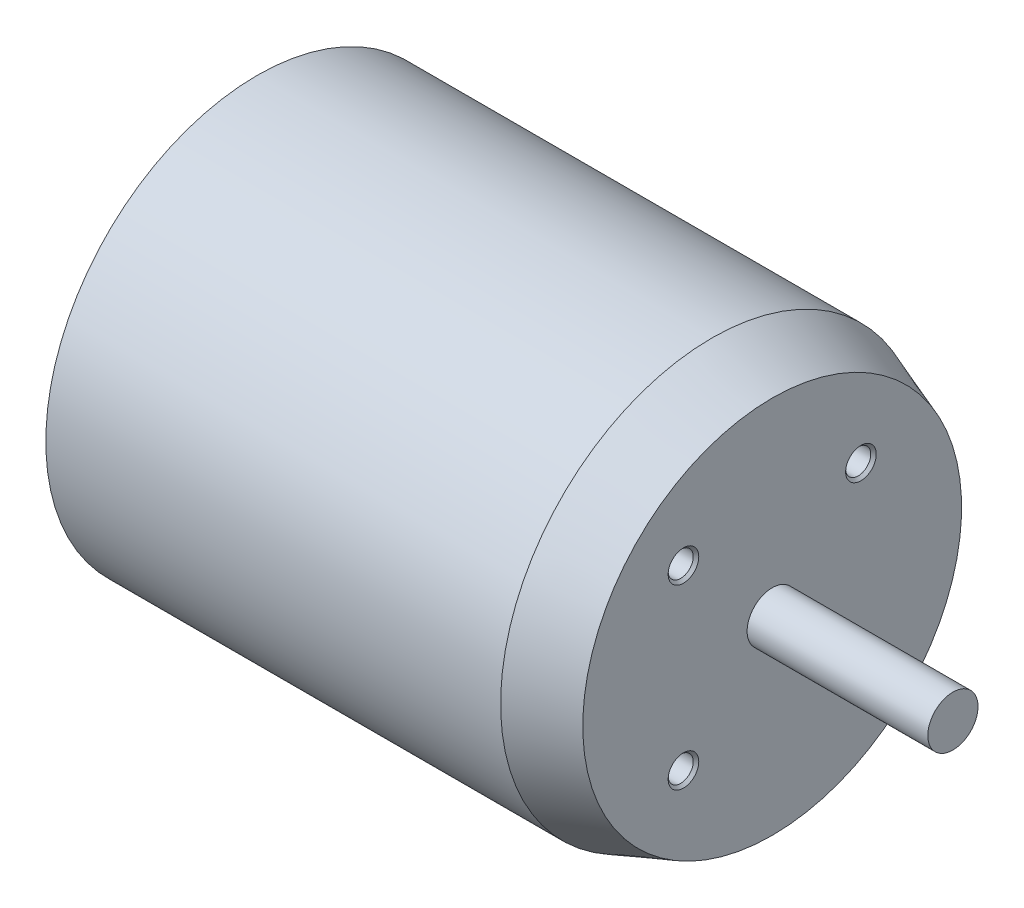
SolidWorks part; units mm, degrees
ref_plane "Front" through (0, 0, 0) normal (0, 0, 1) x (1, 0, 0)
ref_plane "Top" through (0, 0, 0) normal (0, 1, 0) x (1, 0, 0)
ref_plane "Right" through (0, 0, 0) normal (1, 0, 0) x (0, 0, -1)
sketch "Esquisse1" plane through (0, 0, 0) normal (0, 0, 1) x (1, 0, 0)
  line L0 (-55.1177, 0) -> (76.3, 0) construction
  line L1 (7, 5.5) -> (7, 21.05)
  line L2 (7, 21.05) -> (52.3, 21.05)
  line L3 (58.3, 18.8662) -> (58.3, 2.5)
  line L4 (58.3, 2.5) -> (76.3, 2.5)
  line L12 (52.3, 21.05) -> (58.3, 18.8662)
  line L13 (0, 0) -> (0, 5.5)
  line L14 (0, 5.5) -> (7, 5.5)
  line L15 (0, 0) -> (76.3, 0)
  line L16 (76.3, 2.5) -> (76.3, 0)
  point P5 (58.3, 21.05)
  dimension "D1" = 51.3
  dimension "D2" = 18
  dimension "D3" = 5
  dimension "D10" = 42.1
  dimension "D11" = 7
  dimension "D12" = 11
  dimension "D13" = 6
  dimension "D14" = 20
revolve "Révolution1" add sketch "Esquisse1" angle 360 about L0
hole_wizard "Trou taraudé M41 (position à vérifier)" positions "Esquisse3" profile "Esquisse4" tap size "M3" standard "ISO"
sketch "Esquisse3" plane through (58.3, 0, 0) normal (1, 0, 0) x (0, 0, -1)
  line L0 (0, 0) -> (24.3925, 0) construction
  line L3 (0, 0) -> (8.8388, 8.8388) construction
  circle A0 centre (0, 0) radius 12.5 construction
  point P9 (8.8388, 8.8388)
  dimension "D1" = 25
  dimension "D2" = 45
sketch "Esquisse4" plane through (58.3, 8.8388, -8.8388) normal (0, 1, 0) x (0, 0, -1)
  line L0 (0, 0) -> (0, 9.2511)
  line L1 (0, 9.2511) -> (1.25, 8.5)
  line L2 (1.25, 8.5) -> (1.25, 0.275)
  line L3 (1.25, 0.275) -> (1.525, 0)
  line L5 (1.525, 0) -> (0, 0)
  line L6 (-1.25, 0.275) -> (-1.525, 0) construction
  line L10 (0, 9.2511) -> (-1.25, 8.5) construction
  line L11 (0, -6.35) -> (0, 107.95) construction
  dimension "Diamètre du trou pour taraudage" = 2.5
  dimension "Profondeur du trou pour taraudage" = 8.5
  dimension "Diamètre du fraisage entrant" = 3.05
  dimension "Angle du fraisage entrant" = 90
  dimension "Angle de pointe" = 118
pattern_circular "Répétition circulaire1" count 4 over 360 about axis through (0, 0, 0) along (1, 0, 0) of "Trou taraudé M41 (position à vérifier)"
